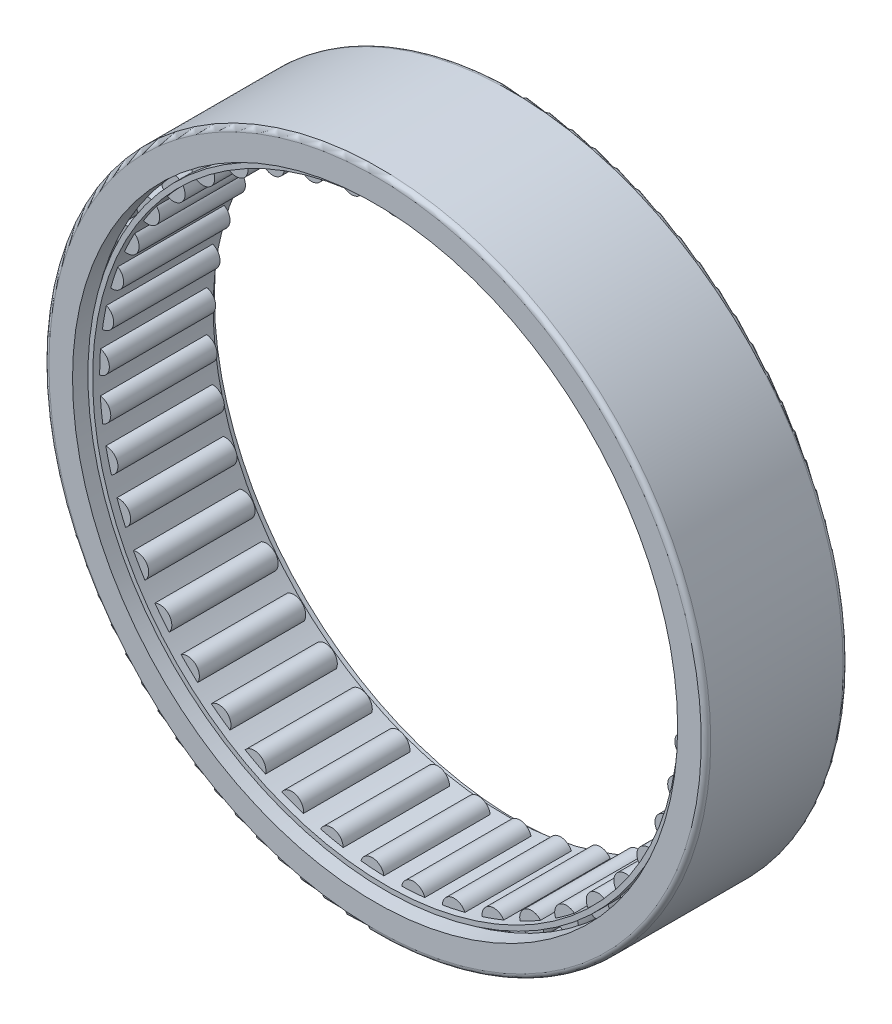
SolidWorks part; units mm, degrees
ref_plane "Front Plane" through (0, 0, 0) normal (0, 0, 1) x (1, 0, 0)
ref_plane "Top Plane" through (0, 0, 0) normal (0, 1, 0) x (1, 0, 0)
ref_plane "Right Plane" through (0, 0, 0) normal (1, 0, 0) x (0, 0, -1)
other "Configuration Table"
sketch "BaseSke" plane through (0, 0, 0) normal (1, 0, 0) x (0, 0, -1)
  line L0 (-47.2296, 0) -> (24.6132, 0) construction
  line L1 (-47.2296, 62.5) -> (24.6132, 62.5) construction
  line L2 (0, 129.5214) -> (0, -86.3012) construction
  line L3 (-11.25, 62.5) -> (-11.25, 65) construction
  line L4 (-15, 70) -> (15, 70) construction
  line L5 (-15, 55) -> (15, 55) construction
  line L6 (-11.25, 60) -> (11.25, 60)
  line L7 (-11.25, 60) -> (-11.25, 62.5)
  line L8 (-11.25, 62.5) -> (11.25, 62.5)
  line L9 (11.25, 60) -> (11.25, 62.5)
  line L10 (-11.25, 65) -> (11.25, 65) construction
  line L11 (11.25, 65) -> (11.25, 62.5) construction
revolve "Roller" add sketch "BaseSke" angle 360 about L8
sketch "OuterRaceSke" plane through (0, 0, 0) normal (1, 0, 0) x (0, 0, -1)
  line L0 (0, 0) -> (0, 87.5396) construction
  line L1 (-15, 70) -> (15, 70)
  line L2 (-15, 70) -> (-15, 64)
  line L3 (-15, 64) -> (-11.275, 64)
  line L4 (15, 70) -> (15, 64)
  line L5 (-50.3916, 0) -> (55.2197, 0) construction
  line L6 (-11.25, 65) -> (11.25, 65) construction
  line L7 (11.275, 64) -> (15, 64)
  line L9 (-11.275, 64) -> (-11.275, 64.98)
  line L10 (-11.275, 64.98) -> (11.275, 64.98)
  line L11 (11.275, 64) -> (11.275, 64.98)
revolve "OuterRace" add sketch "OuterRaceSke" angle 360 about L5
sketch "CageSke" plane through (0, 0, 0) normal (1, 0, 0) x (0, 0, -1)
  line L0 (-70.8626, 0) -> (113.5527, 0) construction
  line L1 (0, 58.441) -> (0, -70.8113) construction
  line L2 (-12.75, 62) -> (12.75, 62)
  line L3 (-12.75, 62) -> (-12.75, 63)
  line L4 (-33.2996, 62.5) -> (13.017, 62.5) construction
  line L5 (-47.2296, 62.5) -> (24.6132, 62.5) construction
  line L6 (0, 129.5214) -> (0, -86.3012) construction
  line L7 (-12.75, 63) -> (12.75, 63)
  line L9 (12.75, 62) -> (12.75, 63)
  point P17 (0, 62)
revolve "Cage" add sketch "CageSke" angle 360 about L0
fillet "Fillet1" radius 1 2 edges at (70, 0, -15) (70, 0, 15)
pattern_circular "CirPatternBall" count 45 over 360 about axis through (0, 0, 0) along (0, 0, 1) of "Roller"
sketch "SimplifiedSke" plane through (0, 0, 0) normal (1, 0, 0) x (0, 0, -1)
  line L0 (37.5911, 0) -> (-37.5911, 0) construction
  line L1 (-13.1351, 62.5) -> (13.151, 62.5) construction
  line L2 (-11.25, 65) -> (11.25, 65)
  line L3 (-11.25, 65) -> (-11.25, 60)
  line L4 (-11.25, 60) -> (11.25, 60)
  line L5 (11.25, 65) -> (11.25, 60)
  line L6 (-47.2296, 62.5) -> (24.6132, 62.5) construction
revolve "Simplified" [suppressed] add sketch "SimplifiedSke" angle 360 about L0
equation "\"D2@BaseSke\" = \"Bearing_Thickness@BaseSke\"*0.75"
equation "\"D1@BaseSke\" =  ( \"Bearing_Outside_Diameter@BaseSke\" + \"Bearing_Inside_Diameter@BaseSke\" )  / 2"
equation "\"D1@OuterRaceSke\" = \"Bearing_Thickness@BaseSke\"*0.75+0.05"
equation "\"D2@OuterRaceSke\" =\"Bearing_Outside_Diameter@BaseSke\" -  ( \"Bearing_Outside_Diameter@BaseSke\" - \"Bearing_Inside_Diameter@BaseSke\"  )/ 2.5 "
equation "\"D1@CageSke\" = \"Bearing_Thickness@BaseSke\"*0.75+3"
equation "\"D2@CageSke\" = ( \"Bearing_Outside_Diameter@BaseSke\" - \"Diameter_Fw@BaseSke\" ) *0.05"
equation "\"D1@CirPatternBall\" =  int(  ( \"Bearing_Outside_Diameter@BaseSke\" + \"Bearing_Inside_Diameter@BaseSke\" )  / 2 *  pi  /  ( \"Bearing_Outside_Diameter@BaseSke\" - \"Bearing_Inside_Diameter@BaseSke\" ) * 3.5 "
